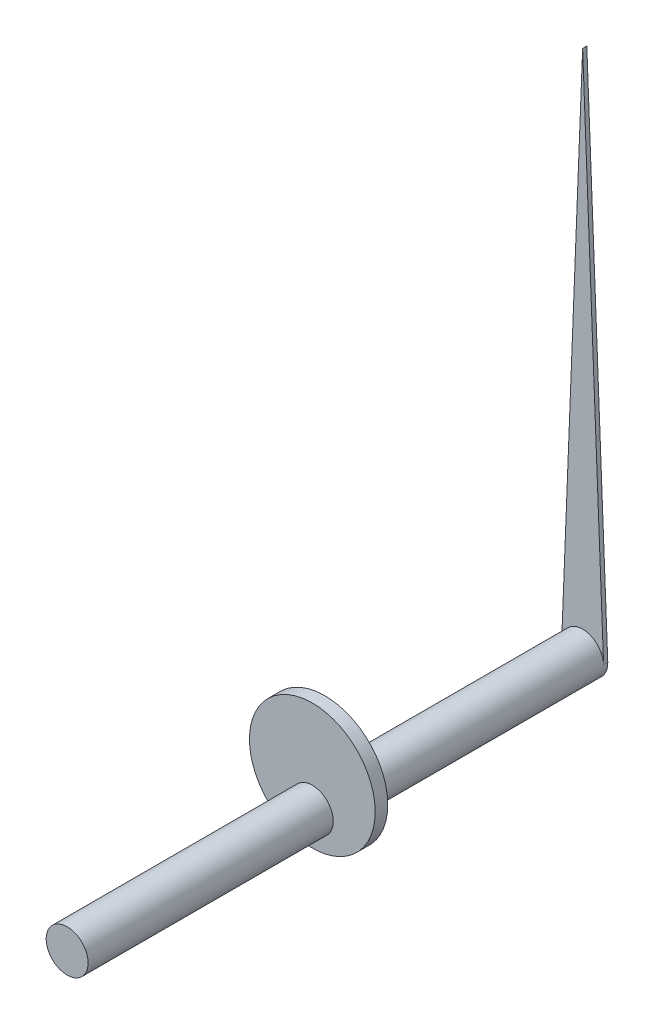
SolidWorks part; units mm, degrees
ref_plane "Front" through (0, 0, 0) normal (0, 0, 1) x (1, 0, 0)
ref_plane "Top" through (0, 0, 0) normal (0, 1, 0) x (1, 0, 0)
ref_plane "Right" through (0, 0, 0) normal (1, 0, 0) x (0, 0, -1)
sketch "Sketch1" plane through (0, 0, 0) normal (0, 0, 1) x (1, 0, 0)
  circle A0 centre (0, 0) radius 5
  dimension "D1" = 10
extrude "Shaft" add sketch "Sketch1" along normal mid plane 123
sketch "Sketch2" plane through (0, 0, 0) normal (0, 0, 1) x (1, 0, 0)
  circle A0 centre (0, 7) radius 15
  dimension "D1" = 30
  dimension "D2" = 7
extrude "Eccentric" add sketch "Sketch2" along normal blind 3
sketch "Sketch3" plane through (0, 0, -61.5) normal (0, 0, -1) x (-1, 0, 0)
  line L0 (-4.996, 0.2) -> (0, 125)
  line L1 (4.996, 0.2) -> (0, 125)
  circle A0 centre (0, 0) radius 5 construction
  arc A1 (-4.996, 0.2) -> (4.996, 0.2) centre (0, 0) ccw
  dimension "D1" = 125
extrude "Minute Hand" add sketch "Sketch3" along normal blind 1
